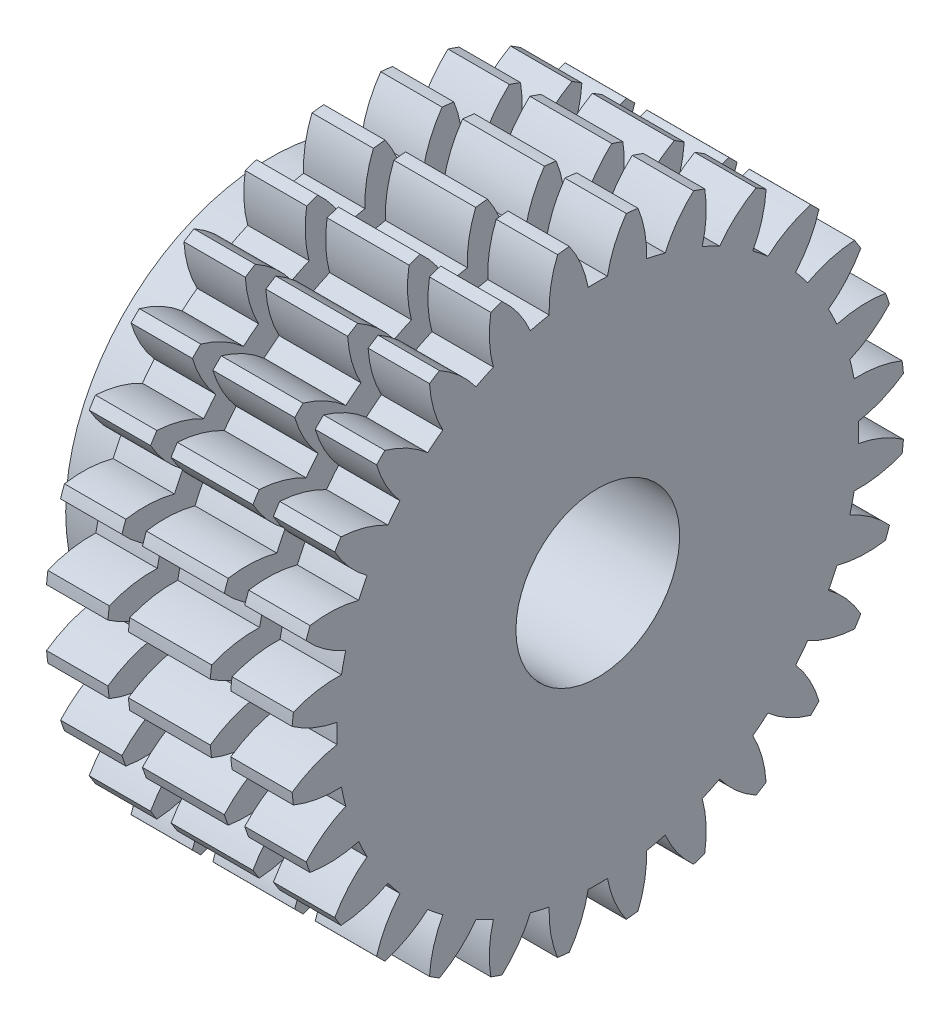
SolidWorks part; units mm, degrees
ref_plane "Plane1" through (0, 0, 0) normal (0, 0, 1) x (1, 0, 0)
ref_plane "Plane2" through (0, 0, 0) normal (0, 1, 0) x (1, 0, 0)
ref_plane "Plane3" through (0, 0, 0) normal (1, 0, 0) x (0, 0, -1)
sketch "HoldingSke" plane through (0, 0, 0) normal (0, 1, 0) x (1, 0, 0)
  line L0 (0, 0) -> (1.7659, -0.9389)
  line L1 (-15, 0) -> (100, 0) construction
  line L2 (0, 0) -> (-2.1039, 2.3779)
  line L3 (0, 0) -> (-11.863, 4.5341)
  line L4 (0, 0) -> (7.6251, 4.0544)
  line L5 (0, 0) -> (-7.4956, -2.7956)
  line L6 (0, 0) -> (-4.9738, -3.3558)
  line L7 (-2.1039, 2.3779) -> (-0.3819, 10.1904)
  line L8 (-76.2, 54.61) -> (-75.5, 54.61)
  line L9 (-71.009, 38.7566) -> (-53.1078, 45.2721)
  line L10 (-76.2, 71.12) -> (104.1128, 71.12)
  line L11 (0, 0) -> (-6, 0)
  line L12 (-76.2, 101.6) -> (-76.181, 101.6)
  line L13 (24.9733, 27.94) -> (52.9518, 28.4284)
  line L14 (24.9733, 27.94) -> (24.9743, 27.94)
  line L15 (24.9733, 27.94) -> (100.4006, 29.5858)
  line L16 (-63.627, -0.5) -> (-12.827, -0.5)
  circle A0 centre (0, 0) radius 2
  circle A1 centre (0, 0) radius 5
  circle A2 centre (0, 0) radius 5
  circle A3 centre (0, 0) radius 2
  dimension "MHD" = 10
  dimension "Hub_dia" = 10
  dimension "Bore" = 4
  dimension "MBD" = 4
  dimension "Num_teeth" = 28
  dimension "Pitch_radius" = 180.3128
  dimension "Pitch" = 2
  dimension "Width" = 6
  dimension "Overall_len" = 8
  dimension "Show_teeth" = 28
  dimension "Thickness" = 6
  dimension "OAL" = 8.0001
  dimension "T_dim" = 0.7
  dimension "Ap" = 20
  dimension "H" = 19.05
  dimension "Backlash" = 0.019
  dimension "Addendum_fac" = 1
  dimension "Dedendum_fac" = 1.25
  dimension "Clearance_fac" = 0.25
  dimension "Dedendum_add" = 0.001
  dimension "Module" = 0.5
sketch "BasProSke" plane through (0, 0, 0) normal (0, 1, 0) x (1, 0, 0)
  line L0 (-10, 0) -> (60, 0) construction
  line L1 (0, 0) -> (0, 7.5)
  line L2 (0, 0) -> (6, 0)
  line L3 (6, 0) -> (6, 7.5)
  line L4 (6, 7.5) -> (0, 7.5)
  dimension "Diameter" = 15
  dimension "Thickness" = 6
revolve "Base-Revolve" add sketch "BasProSke" angle 360 about L0
sketch "TooCutSke" plane through (0, 0, 0) normal (1, 0, 0) x (0, 0, -1)
  line L1 (0, 0) -> (0, 107) construction
  line L2 (0, 0) -> (-0.4257, 6.987) construction
  line L3 (0, 0) -> (-1.5654, 13.8936) construction
  line L4 (-0.4257, 6.987) -> (-0.7827, 6.9468) construction
  arc A0 (0.2356, 6.3696) -> (-0.2356, 6.3696) centre (0, 0) ccw
  arc A1 (0.7134, 7.4915) -> (-0.7134, 7.4915) centre (0, 0) ccw
  circle A2 centre (0, 0) radius 7 construction
  circle A3 centre (0, 0) radius 6.5778 construction
  arc A4 (-0.2356, 6.3696) -> (-0.7134, 7.4915) centre (-2.9887, 5.8597) ccw
  arc A5 (0.7134, 7.4915) -> (0.2356, 6.3696) centre (2.9887, 5.8597) ccw
  dimension "Root_dia" = 12.748
  dimension "Overcut_dia" = 15.0508
  dimension "Pitch_dia" = 14
  dimension "Base_dia" = 13.1557
  dimension "Flank_rad" = 2.8
  dimension "Half_ang" = 6.429
  dimension "Half_CT" = 0.3592
extrude "ToothCut" cut sketch "TooCutSke" along normal through all
fillet "Breaks" [suppressed] radius 0.01
fillet "RootFillets" [suppressed] radius 0.126
pattern_circular "TeethCuts" count 28 every 12.857 about axis through (-10, 0, 0) along (1, 0, 0) of "ToothCut", "RootFillets", "Breaks"
sketch "HubNeaOneSke" plane through (0, 0, 0) normal (-1, 0, 0) x (0, 0, 1)
  circle A0 centre (0, 0) radius 5
  dimension "Diameter" = 10
extrude "HubNearOne" add sketch "HubNeaOneSke" along normal blind 2.0001
sketch "HubNeaBotSke" plane through (0, 0, 0) normal (-1, 0, 0) x (0, 0, 1)
  circle A0 centre (0, 0) radius 5
  dimension "Diameter" = 10
extrude "HubNearBoth" [suppressed] add sketch "HubNeaBotSke" along normal blind 1
ref_plane "FarPln" through (6, 0, 0) normal (1, 0, 0) x (0, 0, -1)
sketch "HubFarSke" plane through (6, 0, 0) normal (1, 0, 0) x (0, 0, -1)
  circle A0 centre (0, 0) radius 5
  dimension "Diameter" = 10
extrude "HubFar" [suppressed] add sketch "HubFarSke" along normal blind 1
sketch "BorSke" plane through (0, 0, 0) normal (1, 0, 0) x (0, 0, -1)
  circle A0 centre (0, 0) radius 2
  dimension "Diameter" = 4
extrude "Bore" cut sketch "BorSke" along normal mid plane 16.0001
sketch "KeySke" plane through (0, 0, 0) normal (1, 0, 0) x (0, 0, -1)
  line L0 (-0.8, 0) -> (-0.8, 2.7)
  line L1 (-0.8, 2.7) -> (0.8, 2.7)
  line L2 (0.8, 2.7) -> (0.8, 0)
  line L3 (0, 0) -> (0, 34) construction
  line L4 (-0.8, 0) -> (0.8, 0)
  dimension "Offset" = 2.7
  dimension "Width" = 1.6
extrude "Keyway" [suppressed] cut sketch "KeySke" along normal mid plane 16.0001
pattern_circular "Keyway2" [suppressed] count 2 every 90 about axis through (-10, 0, 0) along (1, 0, 0)
ref_plane "Plan1" through (4.5, 0, 0) normal (1, 0, 0) x (0, 0, -1)
sketch "Esquisse1" plane through (4.5, 0, 0) normal (1, 0, 0) x (0, 0, -1)
  circle A0 centre (0, 0) radius 5
  circle A1 centre (0, 0) radius 8
  circle A2 centre (0, 0) radius 2 construction
  dimension "D1" = 10
  dimension "D2" = 16
extrude "Enlèv. mat.-Extru.1" cut sketch "Esquisse1" against normal blind 0.5
pattern_linear "Répétition linéaire1" count 2 spacing 2.5 along (-1, 0, 0) of "Enlèv. mat.-Extru.1"
equation "' \"Module@HoldingSke\" = 6.35"
equation "' \"Num_teeth@HoldingSke\" = 12"
equation "' \"Ap@HoldingSke\" =  20"
equation "' \"Width@HoldingSke\" = 0.5 * 25.4"
equation "' \"Hub_dia@HoldingSke\"= 1 * 25.4"
equation "' \"Overall_len@HoldingSke\" = 1.0 * 25.4"
equation "' \"Bore@HoldingSke\" = 0.75 * 25.4"
equation "' \"T_dim@HoldingSke\" = 0.1 * 25.4"
equation "' \"Width@KeySke\" = 0.25 * 25.4"
equation "' \"Show_teeth@HoldingSke\" = 13"
equation "' \"Backlash@HoldingSke\" = 0.009 * 25.4"
equation "' \"Addendum_fac@HoldingSke\" = 1.0"
equation "' \"Dedendum_fac@HoldingSke\" = 1.25"
equation "' \"Dedendum_add@HoldingSke\" = 0.00005 * 25.4"
equation "' \"Clearance_fac@HoldingSke\" = 0.25"
equation "\"Pitch@HoldingSke\" = 1 / \"Module@HoldingSke\""
equation "\"Overcut_dia@TooCutSke\" = (\"Num_teeth@HoldingSke\" + 2 * \"Addendum_fac@HoldingSke\") / \"Pitch@HoldingSke\" + 0.002 * 25.4"
equation "\"Pitch_dia@TooCutSke\" = \"Num_teeth@HoldingSke\" / \"Pitch@HoldingSke\""
equation "\"Base_dia@TooCutSke\" = \"Num_teeth@HoldingSke\" / \"Pitch@HoldingSke\" * cos((\"Ap@HoldingSke\"  * 3.14159265 / 180))"
equation "\"Root_dia@TooCutSke\" = (\"Num_teeth@HoldingSke\" + 2) / \"Pitch@HoldingSke\" - 2 * (\"Addendum_fac@HoldingSke\" + \"Dedendum_fac@HoldingSke\") / \"Pitch@HoldingSke\" - \"Dedendum_add@HoldingSke\" * 2"
equation "\"Half_ang@TooCutSke\" = 180 / \"Num_teeth@HoldingSke\""
equation "\"Half_CT@TooCutSke\" = \"Num_teeth@HoldingSke\" / \"Pitch@HoldingSke\" * sin((3.14159265 / 2 / \"Num_teeth@HoldingSke\")) / 2 - 7 * \"Backlash@HoldingSke\" / 4"
equation "\"Flank_rad@TooCutSke\" = \"Num_teeth@HoldingSke\" / \"Pitch@HoldingSke\" / 5"
equation "\"Radius@RootFillets\" = \"Clearance_fac@HoldingSke\" / \"Pitch@HoldingSke\" + \"Dedendum_add@HoldingSke\""
equation "\"Break_rad@Breaks\" = 0.02 / \"Pitch@HoldingSke\""
equation "\"Thickness@HoldingSke\" = \"Width@HoldingSke\""
equation "\"OAL@HoldingSke\" = \"Thickness@HoldingSke\""
equation "\"MHD@HoldingSke\" = (\"Num_teeth@HoldingSke\" + 2) / \"Pitch@HoldingSke\" - 2 * (\"Addendum_fac@HoldingSke\" + \"Dedendum_fac@HoldingSke\")  / \"Pitch@HoldingSke\" - \"Dedendum_add@HoldingSke\" * 2"
equation "\"MBD@HoldingSke\" = (\"Num_teeth@HoldingSke\" + 2) / \"Pitch@HoldingSke\" - 2 * (\"Addendum_fac@HoldingSke\" + \"Dedendum_fac@HoldingSke\")  / \"Pitch@HoldingSke\" - \"Dedendum_add@HoldingSke\" * 2 - 0.002 * 25.4"
equation "\"MHD@HoldingSke\" = ((sgn( \"MHD@HoldingSke\" - \"Hub_dia@HoldingSke\" )-1)*( \"MHD@HoldingSke\" - \"Hub_dia@HoldingSke\" ))/-2+ \"Hub_dia@HoldingSke\""
equation "\"MBD@HoldingSke\" = ((sgn( \"MBD@HoldingSke\" - \"Bore@HoldingSke\" )-1)*( \"MBD@HoldingSke\" - \"Bore@HoldingSke\" ))/-2+ \"Bore@HoldingSke\""
equation "\"OAL@HoldingSke\" = ((sgn( \"OAL@HoldingSke\" - \"Overall_len@HoldingSke\" )+1)*( \"OAL@HoldingSke\" - \"Overall_len@HoldingSke\" ))/2 + \"Overall_len@HoldingSke\" + 0.000002 * 25.4"
equation "\"Num_teeth@TeethCuts\" = int( \"Show_teeth@HoldingSke\" ) + 1"
equation "\"Num_teeth@TeethCuts\" = ((sgn( \"Num_teeth@TeethCuts\" - \"Num_teeth@HoldingSke\" )-1)*( \"Num_teeth@TeethCuts\" - \"Num_teeth@HoldingSke\" ))/-2+ \"Num_teeth@HoldingSke\""
equation "\"Num_teeth@TeethCuts\" = ((sgn( \"Num_teeth@TeethCuts\" - 2.0)+1)*( \"Num_teeth@TeethCuts\" - 2.0))/2 +2.0"
equation "\"Angle@TeethCuts\" = 360.0 / \"Num_teeth@HoldingSke\""
equation "\"Diameter@BasProSke\" = (\"Num_teeth@HoldingSke\" + 2 * \"Addendum_fac@HoldingSke\") / \"Pitch@HoldingSke\""
equation "\"Thickness@BasProSke\"  = \"Thickness@HoldingSke\""
equation "' \"Fillet_rad@BasProSke\" =  \"Thickness@HoldingSke\" * 0.05"
equation "\"MHD@HoldingSke\" = ((sgn( \"MHD@HoldingSke\" - \"Root_dia@TooCutSke\" )-1)*( \"MHD@HoldingSke\" - \"Root_dia@TooCutSke\" ))/-2+ \"Root_dia@TooCutSke\""
equation "\"Diameter@HubNeaOneSke\" = \"MHD@HoldingSke\""
equation "\"Length@HubNearOne\" = \"OAL@HoldingSke\" - \"Thickness@BasProSke\""
equation "\"Diameter@HubNeaBotSke\" = \"MHD@HoldingSke\""
equation "\"Length@HubNearBoth\" = ( \"OAL@HoldingSke\" - \"Thickness@BasProSke\" ) / 2.0"
equation "\"Thickness@FarPln\" = \"Thickness@BasProSke\""
equation "\"Diameter@HubFarSke\" = \"MHD@HoldingSke\""
equation "\"Length@HubFar\" = ( \"OAL@HoldingSke\" - \"Thickness@BasProSke\" ) / 2.0"
equation "\"Diameter@BorSke\" = \"MBD@HoldingSke\""
equation "\"D1@Bore\" = \"OAL@HoldingSke\" * 2.0"
equation "\"D1@Keyway\" = \"OAL@HoldingSke\" * 2.0"
equation "\"Offset@KeySke\" = \"T_dim@HoldingSke\" + \"MBD@HoldingSke\" / 2.0"
